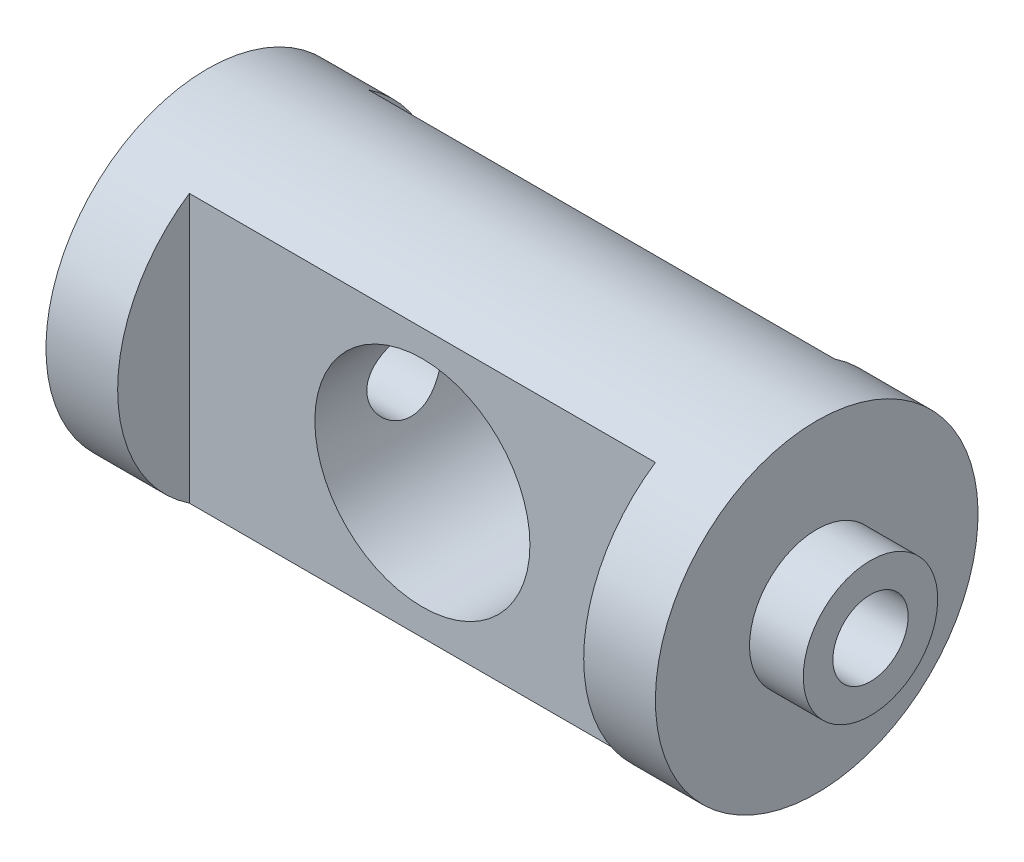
SolidWorks part; units mm, degrees
ref_plane "Front Plane" through (0, 0, 0) normal (0, 0, 1) x (1, 0, 0)
ref_plane "Top Plane" through (0, 0, 0) normal (0, 1, 0) x (1, 0, 0)
ref_plane "Right Plane" through (0, 0, 0) normal (1, 0, 0) x (0, 0, -1)
sketch "Sketch1" plane through (0, 0, 0) normal (0, 0, 1) x (1, 0, 0)
  line L0 (0, 0) -> (0, 3.75)
  line L1 (0, 3.75) -> (3, 3.75)
  line L2 (3, 3.75) -> (3, 9)
  line L3 (3, 9) -> (37, 9)
  line L4 (37, 9) -> (37, 3.75)
  line L5 (37, 3.75) -> (40, 3.75)
  line L6 (40, 3.75) -> (40, 0)
  line L7 (40, 0) -> (0, 0)
  dimension "D1" = 9
  dimension "D2" = 3.75
  dimension "D3" = 3
  dimension "D4" = 3
  dimension "D5" = 34
revolve "Revolve1" add sketch "Sketch1" angle 360 about L7
sketch "Sketch2" plane through (0, 0, 0) normal (0, 0, 1) x (1, 0, 0)
  line L0 (0, 0) -> (40, 0) construction
  line L1 (40, -3.75) -> (40, 3.75) construction
  circle A0 centre (20, 0) radius 6
  dimension "D1" = 12
extrude "Extrude1" cut sketch "Sketch2" against normal mid plane 20
sketch "Sketch3" plane through (40, 0, 0) normal (1, 0, 0) x (0, 0, -1)
  point P0 (0, 0)
hole_wizard "M5 Tapped Hole1" positions "3DSketch1" profile "Sketch4" tap size "M5" standard "ISO"
sketch3d "3DSketch1"
  point P0 (40, 0, 0)
sketch "Sketch4" plane through (40, 0, 0) normal (0, 1, 0) x (0, 0, -1)
  line L0 (0, 0) -> (0, 40)
  line L1 (0, 40) -> (2.1, 40)
  line L2 (2.1, 40) -> (2.1, 0)
  line L5 (2.1, 0) -> (0, 0)
  line L11 (0, -6.35) -> (0, 107.95) construction
  dimension "Thru Tap Drill Dia." = 4.2
  dimension "Thru Tap Drill Depth" = 40
sketch "Sketch5" plane through (0, 0, 0) normal (0, 1, 0) x (1, 0, 0)
  line L0 (3, -9) -> (14, -9) construction
  line L1 (7, -9) -> (33, -9)
  line L2 (7, -9) -> (7, -5)
  line L3 (7, -5) -> (33, -5)
  line L4 (33, -9) -> (33, -5)
  line L5 (3, 9) -> (3, -9) construction
  line L6 (37, -9) -> (37, 9) construction
  line L7 (37, 9) -> (26, 9) construction
  dimension "D1" = 4
  dimension "D2" = 4
  dimension "D3" = 14
extrude "Extrude2" cut sketch "Sketch5" against normal mid plane 20
mirror "Mirror1" about plane through (0, 0, 0) normal (0, 0, 1) of "Extrude2"
